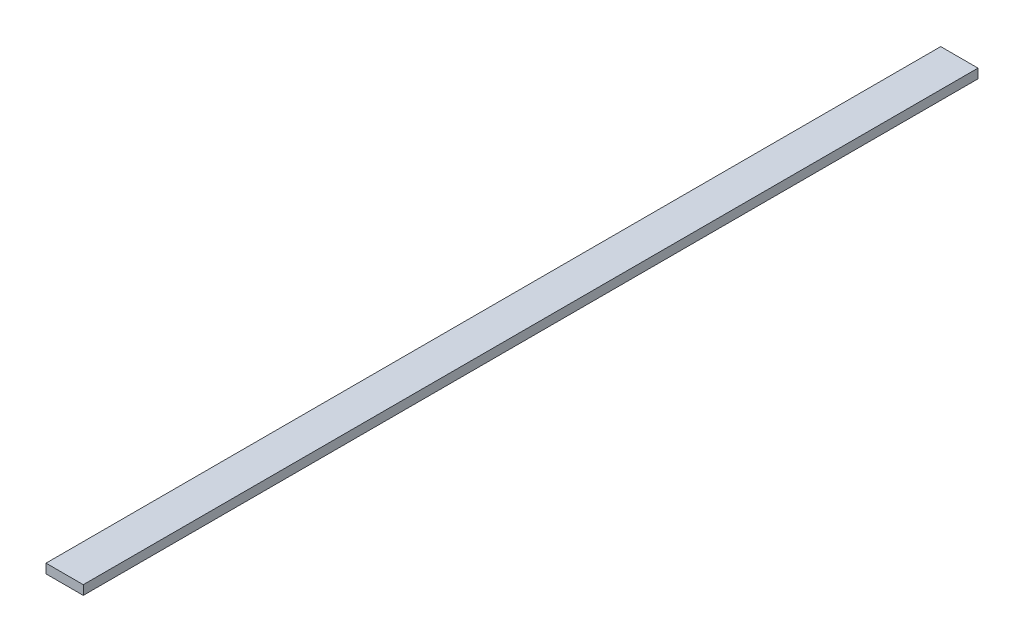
SolidWorks part; units mm, degrees
ref_plane "Front Plane" through (0, 0, 0) normal (0, 0, 1) x (1, 0, 0)
ref_plane "Top Plane" through (0, 0, 0) normal (0, 1, 0) x (1, 0, 0)
ref_plane "Right Plane" through (0, 0, 0) normal (1, 0, 0) x (0, 0, -1)
sketch "Sketch1" plane through (0, 0, 0) normal (0, 0, 1) x (1, 0, 0)
  line L1 (-50.8, 12.7) -> (50.8, 12.7)
  line L2 (-50.8, 12.7) -> (-50.8, -12.7)
  line L3 (-50.8, -12.7) -> (50.8, -12.7)
  line L4 (50.8, 12.7) -> (50.8, -12.7)
  line L5 (-50.8, 12.7) -> (50.8, -12.7) construction
  line L6 (-50.8, -12.7) -> (50.8, 12.7) construction
  point P0 (0, 0)
  dimension "D1" = 25.4
  dimension "D2" = 101.6
extrude "Boss-Extrude1" add sketch "Sketch1" along normal blind 2438.4
